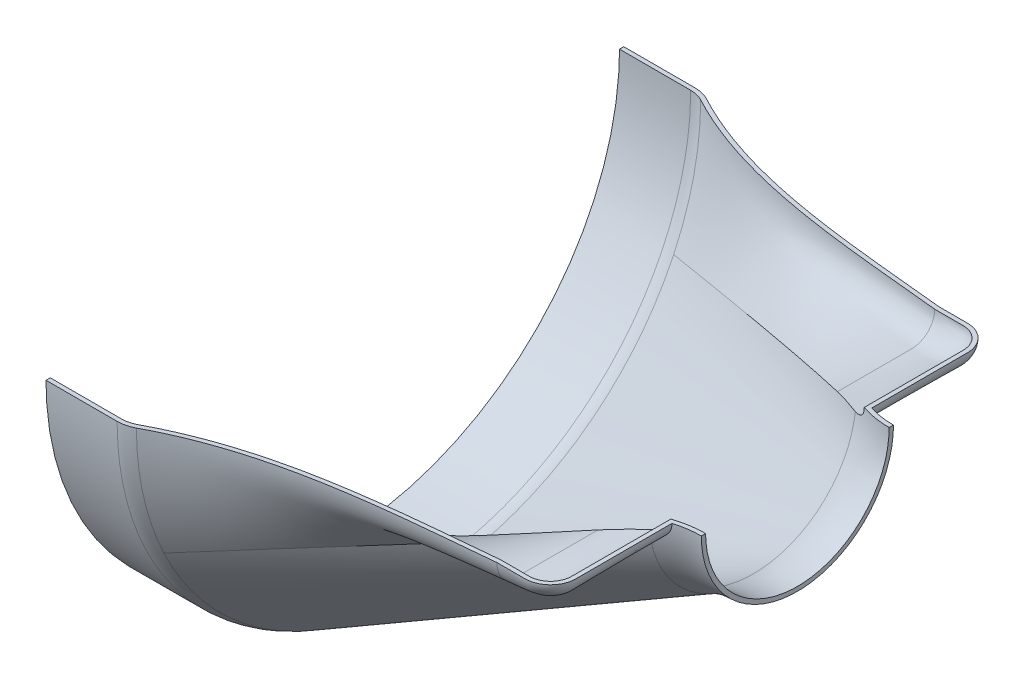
SolidWorks part; units mm, degrees
ref_plane "Vorne" through (0, 0, 0) normal (0, 0, 1) x (1, 0, 0)
ref_plane "Oben" through (0, 0, 0) normal (0, 1, 0) x (1, 0, 0)
ref_plane "Rechts" through (0, 0, 0) normal (1, 0, 0) x (0, 0, -1)
sketch "Skizze1" plane through (0, 0, 0) normal (0, 1, 0) x (1, 0, 0)
  line L0 (0, 0) -> (770.7263, 0) construction
  line L1 (0, 200) -> (50, 200)
  line L2 (59.4254, 197.6398) -> (294.1318, 72.2297)
  line L3 (2, 198) -> (50, 198) construction
  line L4 (0, 198) -> (50, 198) construction
  line L6 (58.4829, 195.8758) -> (293.1892, 70.4658) construction
  line L8 (0, 200) -> (0, 198) construction
  line L9 (448, 0) -> (450, 0) construction
  line L12 (0, 200) -> (0, 196.253) construction
  line L19 (2, 198) -> (2, 196.253) construction
  line L20 (385.5, 64.5) -> (325, 64.5) construction
  line L21 (385.5, 62.5) -> (325, 62.5) construction
  arc A0 (50, 200) -> (59.4254, 197.6398) centre (50, 180) cw
  arc A1 (50, 198) -> (58.4829, 195.8758) centre (50, 180) cw construction
  arc A2 (325, 62.5) -> (293.1892, 70.4658) centre (325, 130) cw construction
  arc A4 (325, 64.5) -> (294.1318, 72.2297) centre (325, 130) cw
  arc A9 (385.5, 64.5) -> (450, 0) centre (385.5, 0) cw construction
  arc A10 (385.5, 62.5) -> (448, 0) centre (385.5, 0) cw construction
  point P14 (87.3818, 188.4588)
  point P15 (510.3654, -55.7509)
  dimension "D2" = 20
  dimension "D4" = 2
  dimension "D5" = 65.5
  dimension "D3" = 400
  dimension "D6" = 50
  dimension "D8" = 325
  dimension "D13" = 450
surface "Oberfläche-Rotation1" sketch "Skizze1" parameters "D1"=180
ref_plane "Ebene1" through (100, 0, 0) normal (1, 0, 0) x (0, 0, -1)
ref_plane "Ebene2" through (269, 0, 0) normal (1, 0, 0) x (0, 0, -1)
sketch "Skizze12" plane through (0, 0, 0) normal (0, 0, 1) x (1, 0, 0)
  line L0 (269, 43.8329) -> (269, -185.9672)
  line L3 (0, -200) -> (0, 0) construction
  dimension "D1" = 269
sketch "Skizze9" plane through (0, 0, 0) normal (0, 0, 1) x (1, 0, 0)
  line L0 (-18.0175, -109.937) -> (269, -16)
  line L1 (269, -16) -> (269, 0) construction
  line L2 (269, 0) -> (269, -85.6583) construction
sketch "Skizze11" plane through (269, 0, 0) normal (1, 0, 0) x (0, 0, -1)
  line L0 (-136.5, -16) -> (-81.0952, -16) construction
  line L2 (-136.5, -16) -> (-84.1508, -16)
  arc A0 (-152.5, 0) -> (-136.5, -16) centre (-136.5, 0) ccw construction
  arc A2 (-152.5, 0) -> (-136.5, -16) centre (-136.5, 0) ccw
other "Fläche löschen1"
surface "Oberfläche-Ausformung1"
sketch "Skizze14" plane through (0, 0, 0) normal (0, 1, 0) x (1, 0, 0)
  line L0 (269, -152.5) -> (289, -152.5)
  line L1 (304, -137.5) -> (304, -62.4351)
  line L2 (269, -152.5) -> (269, -84.1508) construction
  arc A0 (289, -152.5) -> (304, -137.5) centre (289, -137.5) ccw
  dimension "D2" = 15
  dimension "D1" = 35
ref_plane "Ebene3" through (0, 0, 130) normal (0, 0, 1) x (1, 0, 0)
sketch "Skizze15" plane through (0, 0, 130) normal (0, 0, 1) x (1, 0, 0)
  line L0 (269, -16) -> (289, -16)
  line L1 (304, -1) -> (304, 0)
  line L3 (294.1318, 0) -> (325, 0) construction
  arc A0 (289, -16) -> (304, -1) centre (289, -1) ccw
  dimension "D1" = 15
surface "Oberfläche-Ausformung5"
mirror "Spiegeln1" about plane through (0, 0, 0) normal (0, 0, 1)
surface "Oberfläche-Trimmen1"
surface "Oberfläche-Trimmen2"
sketch3d "3D-Skizze1"
  line L1 (0, 0, 200) -> (50, 0, 200)
  line L3 (50, 0, -200) -> (0, 0, -200)
  line L4 (0, 0, 200) -> (0, 0, -200)
  line L5 (325, 0, 64.5) -> (325, 0, -64.5)
  arc A1 (59.4254, 0, 197.6398) -> (50, 0, 200) centre (50, 0, 180) ccw
  arc A3 (325, 0, 64.5) -> (304, 0, 67.9577) centre (325, 0, 130) ccw
  arc A5 (325, 0, -64.5) -> (304, 0, -67.9577) centre (325, 0, -130) ccw
  arc A7 (59.4254, 0, -197.6398) -> (50, 0, -200) centre (50, 0, -180) ccw
  spline S1 degree 3 poles (59.4254, 0, 197.6398) (90.4564, 0.0011, 181.0594) (141.5303, 0.048, 166.7271) (213.9183, 0.0779, 157.5706) (250.7006, 0.046, 154.3405) (269, 0, 152.5) knots 0 0 0 0 0.5 0.75 1 1 1 1
  spline S3 degree 3 poles (269, 0, 152.5) (270.6373, 0, 152.5) (273.9118, 0, 152.5) (278.8551, 0, 152.5) (283.8636, 0, 152.5) (287.2713, 0, 152.5) (289.9507, 0, 152.5) (291.8732, 0, 152.3185) (294.6992, 0, 151.4803) (297.3386, 0, 150.0878) (299.2781, 0, 148.505) (300.6188, 0, 147.026) (301.5085, 0, 145.8238) (302.2718, 0, 144.5423) (302.9025, 0, 143.1971) (303.3943, 0, 141.8039) (303.7454, 0, 140.3789) (303.9542, 0, 138.9383) (304, 0, 137.9777) (304, 0, 131.1921) (304, 0, 118.6162) (304, 0, 99.8408) (304, 0, 82.9672) (304, 0, 72.3466) (304, 0, 67.9577) knots 0 0 0 0 0.045768 0.091537 0.137305 0.183073 0.183073 0.208243 0.233413 0.258583 0.283753 0.296338 0.308923 0.321508 0.334093 0.346678 0.359263 0.371848 0.384433 0.384433 0.5506 0.716768 0.882935 1 1 1 1
  spline S5 degree 3 poles (269, 0, -152.5) (270.6373, 0, -152.5) (273.9118, 0, -152.5) (278.8551, 0, -152.5) (283.8636, 0, -152.5) (287.2713, 0, -152.5) (289.9507, 0, -152.5) (291.8732, 0, -152.3185) (294.6992, 0, -151.4803) (297.3386, 0, -150.0878) (299.2781, 0, -148.505) (300.6188, 0, -147.026) (301.5085, 0, -145.8238) (302.2718, 0, -144.5423) (302.9025, 0, -143.1971) (303.3943, 0, -141.8039) (303.7454, 0, -140.3789) (303.9542, 0, -138.9383) (304, 0, -137.9777) (304, 0, -131.1921) (304, 0, -118.6162) (304, 0, -99.8408) (304, 0, -82.9672) (304, 0, -72.3466) (304, 0, -67.9577) knots 0 0 0 0 0.045768 0.091537 0.137305 0.183073 0.183073 0.208243 0.233413 0.258583 0.283753 0.296338 0.308923 0.321508 0.334093 0.346678 0.359263 0.371848 0.384433 0.384433 0.5506 0.716768 0.882935 1 1 1 1
  spline S7 degree 3 poles (59.4254, 0, -197.6398) (90.4564, 0.0011, -181.0594) (141.5303, 0.048, -166.7271) (213.9183, 0.0779, -157.5706) (250.7006, 0.046, -154.3405) (269, 0, -152.5) knots 0 0 0 0 0.5 0.75 1 1 1 1
  point P4 (50, -20, 180)
  point P10 (325, 65.5, 130)
  point P16 (325, -65.5, -130)
  point P22 (50, 20, -180)
surface "Oberflächenausfüllung1" sketch "3D-Skizze1"
sketch3d "3D-Skizze2"
  arc A0 (325, 0, -64.5) -> (325, 0, 64.5) centre (325, 0, 0) ccw construction
  arc A1 (325, 0, -64.5) -> (325, 0, 64.5) centre (325, 0, 0) ccw
  spline S0 degree 5 poles (325.0424, -1821.776, -725.2086) (324.9966, 148.071, -580.2484) (325.0002, -8.0034, -435.2882) (325, 0.2542, -290.328) (325, -0.2615, 4.152) (325, 0.2676, 298.6319) (325.0002, -7.9224, 448.1517) (324.9966, 145.0228, 597.6715) (325.0421, -1808.9121, 747.1913) knots -5.121772 -5.121772 -5.121772 -5.121772 -5.121772 -5.121772 0.49684 0.49684 0.49684 6.29218 6.29218 6.29218 6.29218 6.29218 6.29218 only from (325, 0.0004, -64.5) to (325, 0.0003, 64.5) construction
  spline S1 degree 5 poles (325, 0.0004, -64.5) (325, -0.0014, -51.6815) (325, -0.0003, -38.863) (325, 0.0018, -26.0446) (325, -0.0023, -0.2446) (325, 0.0016, 25.5554) (325, -0.0001, 38.5369) (325, -0.0011, 51.5185) (325, 0.0003, 64.5) knots 0 0 0 0 0 0 0.49684 0.49684 0.49684 1 1 1 1 1 1
  point P5 (260.5, 0, 0)
  point P6 (260.5, 0, 0)
surface "Oberflächenausfüllung2" sketch "3D-Skizze2"
sketch3d "3D-Skizze3"
  arc A0 (0, 0, -200) -> (0, 0, 200) centre (0, 0, 0) ccw construction
  arc A1 (0, 0, -200) -> (0, 0, 200) centre (0, 0, 0) ccw
  spline S0 degree 5 poles (0.0378, -1622.996, 1133.2256) (-0.0009, 38.8116, 939.2841) (0, 0.1213, 745.3426) (0, 0.0086, 551.4011) (0, -0.0011, 353.3387) (0, -0.0001, 155.2763) (0, -0.0001, 151.1554) (0, 0, 138.7926) (0, 0, 126.4299) (0, 0.0001, 118.188) (0, 0.0002, 89.5238) (0, 0.0001, 60.8595) (0, 0.0001, 40.4372) (0, 0.0001, -0.3234) (0, 0, -41.084) (0, 0, -61.4222) (0, 0, -91.9864) (0, 0, -122.5507) (0, -0.0001, -132.7768) (0, -0.0007, -375.2577) (0, 0.0052, -617.7386) (0, -0.18, -849.9934) (-0.0009, 39.301, -1082.2482) (0.0334, -1437.4277, -1314.5031) knots -2.333064 -2.333064 -2.333064 -2.333064 -2.333064 -2.333064 0.091205 0.091205 0.091205 0.142716 0.142716 0.142716 0.245739 0.245739 0.245739 0.501019 0.501019 0.501019 0.755246 0.755246 0.755246 0.883072 0.883072 0.883072 3.786258 3.786258 3.786258 3.786258 3.786258 3.786258 only from (0, 0.0002, 200) to (0, 0.0001, -200) construction
  spline S1 degree 5 poles (0, 0.0002, 200) (0, -0.0001, 192.7036) (0, -0.0002, 185.4073) (0, -0.0002, 178.1109) (0, -0.0002, 166.6936) (0, -0.0001, 155.2763) (0, -0.0001, 151.1554) (0, 0, 138.7926) (0, 0, 126.4299) (0, 0.0001, 118.188) (0, 0.0002, 89.5238) (0, 0.0001, 60.8595) (0, 0.0001, 40.4372) (0, 0.0001, -0.3234) (0, 0, -41.084) (0, 0, -61.4222) (0, 0, -91.9864) (0, 0, -122.5507) (0, -0.0001, -132.7768) (0, -0.0001, -152.357) (0, -0.0001, -171.9373) (0, -0.0001, -181.2916) (0, -0.0001, -190.6458) (0, 0.0001, -200) knots 0 0 0 0 0 0 0.091205 0.091205 0.091205 0.142716 0.142716 0.142716 0.245739 0.245739 0.245739 0.501019 0.501019 0.501019 0.755246 0.755246 0.755246 0.883072 0.883072 0.883072 1 1 1 1 1 1
  point P3 (-200, 0, 0)
  point P4 (-200, 0, 0)
surface "Oberflächenausfüllung3" sketch "3D-Skizze3"
surface "Oberfläche-Zusammenfügen4"
surface "Oberfläche-Zusammenfügen5"
surface "Oberfläche-Zusammenfügen6"
surface "Oberfläche-Zusammenfügen7"
surface "Oberfläche-Zusammenfügen8"
shell "Wandung1" thickness 3
